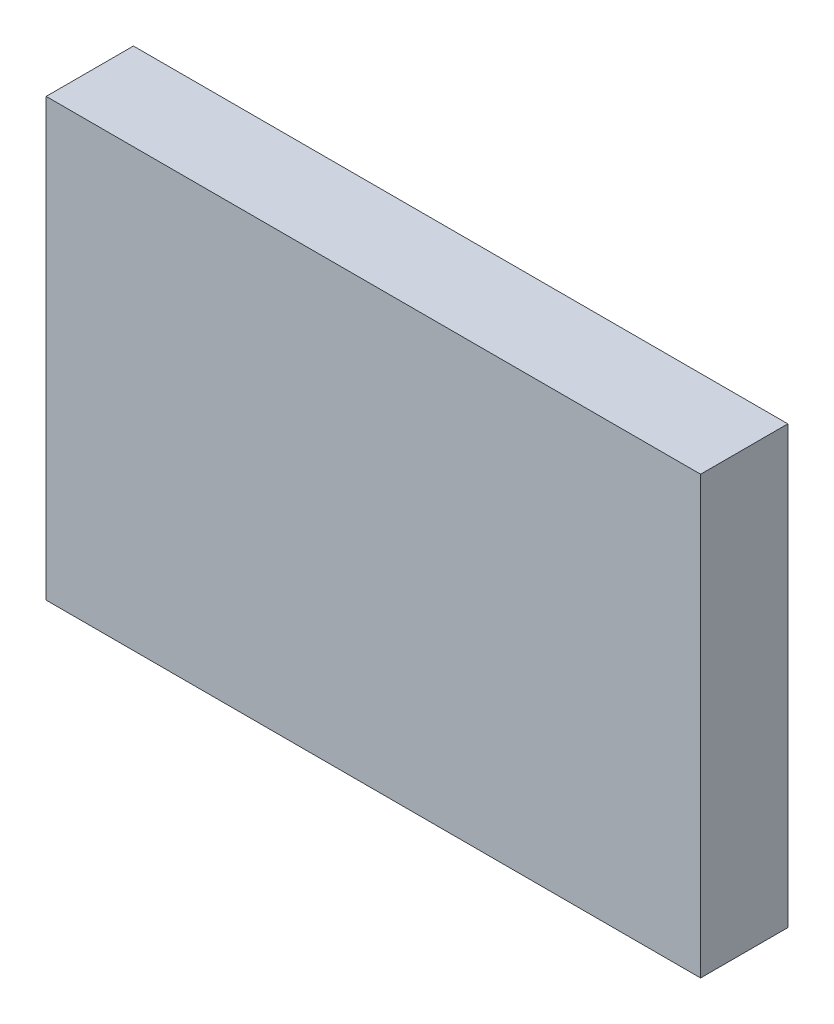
SolidWorks part; units mm, degrees
ref_plane "前视基准面" through (0, 0, 0) normal (0, 0, 1) x (1, 0, 0)
ref_plane "上视基准面" through (0, 0, 0) normal (0, 1, 0) x (1, 0, 0)
ref_plane "右视基准面" through (0, 0, 0) normal (1, 0, 0) x (0, 0, -1)
other "Configuration Table"
sketch "草图1" plane through (0, 0, 0) normal (0, 0, 1) x (1, 0, 0)
  line L1 (-75, -50) -> (75, -50)
  line L2 (-75, -50) -> (-75, 50)
  line L3 (-75, 50) -> (75, 50)
  line L4 (75, -50) -> (75, 50)
  line L5 (-75, -50) -> (75, 50) construction
  line L6 (-75, 50) -> (75, -50) construction
extrude "凸台-拉伸1" add sketch "草图1" against normal blind 20
